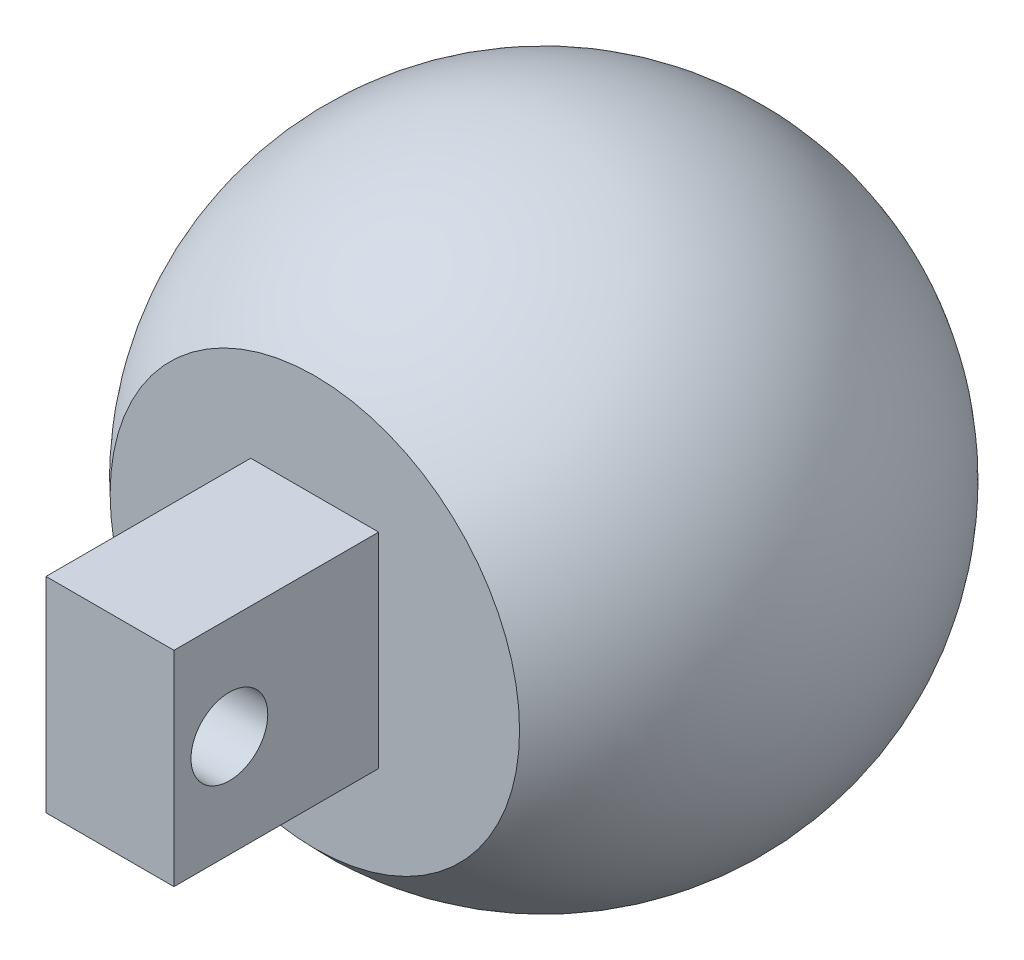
SolidWorks part; units mm, degrees
ref_plane "Ebene vorne" through (0, 0, 0) normal (0, 0, 1) x (1, 0, 0)
ref_plane "Ebene oben" through (0, 0, 0) normal (0, 1, 0) x (1, 0, 0)
ref_plane "Ebene rechts" through (0, 0, 0) normal (1, 0, 0) x (0, 0, -1)
sketch "Skizze1" plane through (0, 0, 0) normal (0, 1, 0) x (1, 0, 0)
  line L0 (-46.1014, 20.6378) -> (-62.1014, 20.6378)
  line L1 (-62.1014, 62.5263) -> (-62.1014, 20.6378)
  arc A0 (-62.1014, 62.5263) -> (-46.1014, 20.6378) centre (-62.1014, 38.5263) cw
  dimension "D1" = 16
  dimension "D2" = 24
revolve "Rotation1" add sketch "Skizze1" angle 360 about L1
sketch "Skizze2" plane through (0, 0, -20.6378) normal (0, 0, 1) x (1, 0, 0)
  line L1 (-57.1133, -8.0834) -> (-67.1133, -8.0834)
  line L2 (-57.1133, -8.0834) -> (-57.1133, 7.9166)
  line L3 (-57.1133, 7.9166) -> (-67.1133, 7.9166)
  line L4 (-67.1133, -8.0834) -> (-67.1133, 7.9166)
  line L5 (-57.1133, -8.0834) -> (-67.1133, 7.9166) construction
  line L6 (-57.1133, 7.9166) -> (-67.1133, -8.0834) construction
  point P0 (-62.1133, -0.0834)
  dimension "D1" = 10
  dimension "D2" = 16
extrude "Linear austragen1" add sketch "Skizze2" along normal blind 16
sketch "Skizze7" plane through (-57.1133, 0, 0) normal (1, 0, 0) x (0, 0, -1)
  circle A0 centre (8.9711, -0.0834) radius 3
extrude "Schnitt-Linear austragen2" cut sketch "Skizze7" against normal through all
